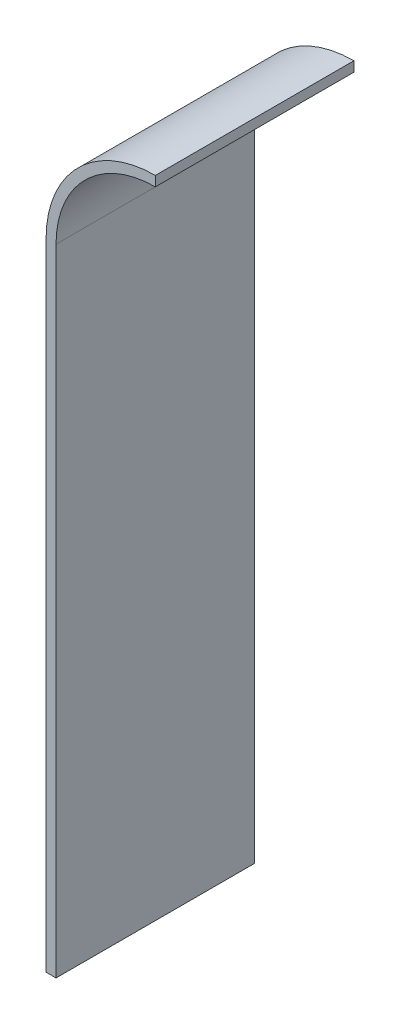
SolidWorks part; units mm, degrees
ref_plane "Front Plane" through (0, 0, 0) normal (0, 0, 1) x (1, 0, 0)
ref_plane "Top Plane" through (0, 0, 0) normal (0, 1, 0) x (1, 0, 0)
ref_plane "Right Plane" through (0, 0, 0) normal (1, 0, 0) x (0, 0, -1)
sketch "Sketch1" plane through (0, 0, 0) normal (0, 0, 1) x (1, 0, 0)
  line L0 (-10, 0) -> (-10, -64)
  line L1 (0, 0) -> (0, 10) construction
  line L2 (-11, 0) -> (-11, -64)
  line L3 (0, 10) -> (0, 11)
  line L4 (-10, -64) -> (-11, -64)
  arc A0 (0, 10) -> (-10, 0) centre (0, 0) ccw
  arc A1 (0, 11) -> (-11, 0) centre (0, 0) ccw
  dimension "D1" = 10
  dimension "D2" = 75
  dimension "D3" = 1
extrude "Extrude1" add sketch "Sketch1" along normal blind 20
